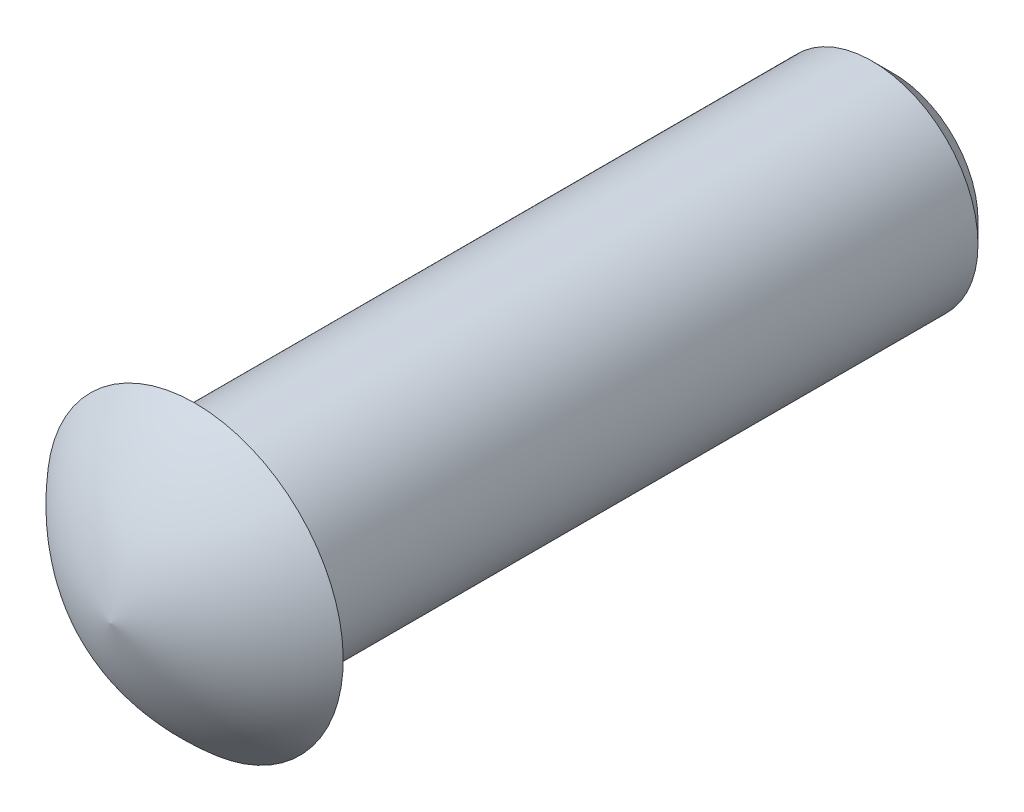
SolidWorks part; units mm, degrees
ref_plane "前视基准面" through (0, 0, 0) normal (0, 0, 1) x (1, 0, 0)
ref_plane "上视基准面" through (0, 0, 0) normal (0, 1, 0) x (1, 0, 0)
ref_plane "右视基准面" through (0, 0, 0) normal (1, 0, 0) x (0, 0, -1)
sketch "草图1" plane through (0, 0, 0) normal (0, 0, 1) x (1, 0, 0)
  circle A0 centre (0, 0) radius 5
  dimension "D1" = 10
extrude "凸台-拉伸1" add sketch "草图1" along normal blind 33
sketch "草图2" plane through (0, 0, 0) normal (1, 0, 0) x (0, 0, -1)
  line L0 (-33, 0) -> (-33, 7)
  line L1 (-33, 5) -> (-33, -5) construction
  line L2 (-33, 0) -> (-37, 0)
  arc A0 (-33, 7) -> (-37, 0) centre (-25.1865, -2.1077) ccw
  dimension "D1" = 12
  dimension "D2" = 7
  dimension "D3" = 4
revolve "旋转1" add sketch "草图2" angle 360 about L2
chamfer "倒角1" distance 1 angle 45 1 edges at (5, 0, 0)
